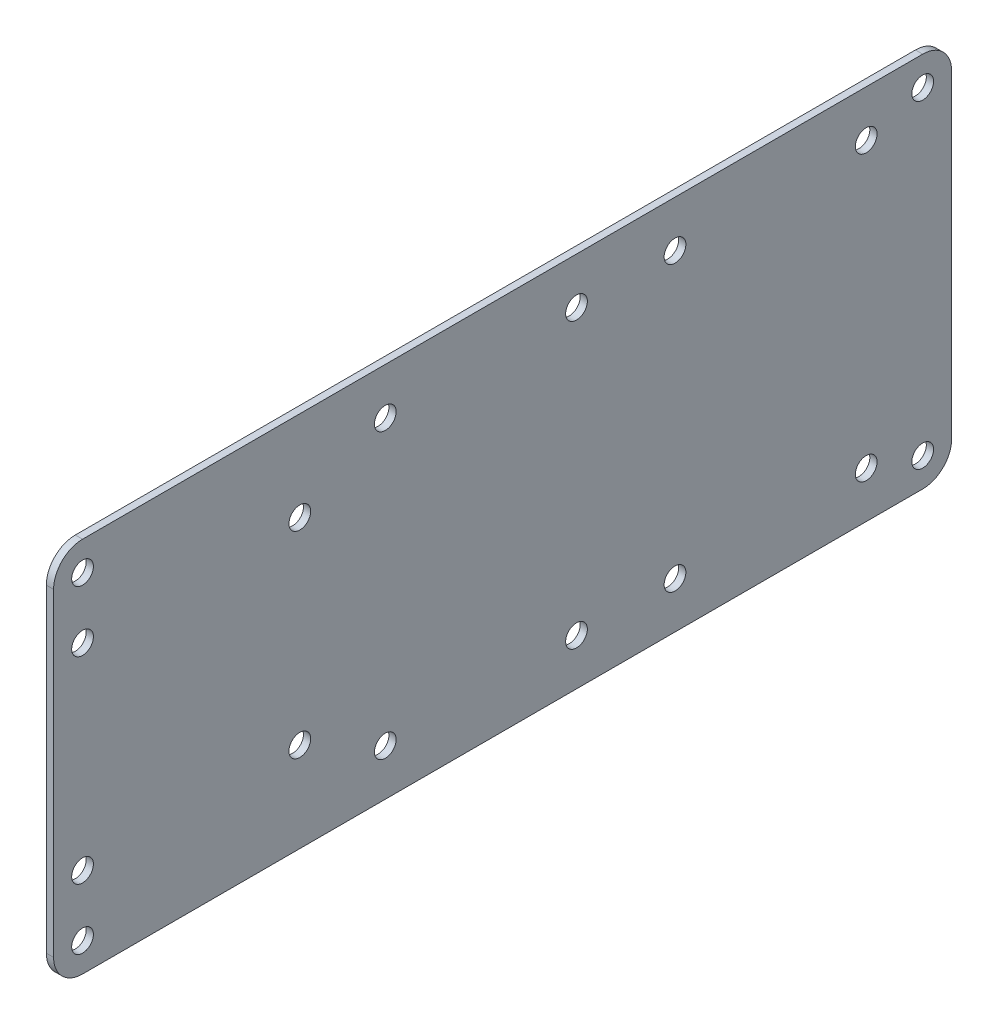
SolidWorks part; units mm, degrees
ref_plane "Front Plane" through (0, 0, 0) normal (0, 0, 1) x (1, 0, 0)
ref_plane "Top Plane" through (0, 0, 0) normal (0, 1, 0) x (1, 0, 0)
ref_plane "Right Plane" through (0, 0, 0) normal (1, 0, 0) x (0, 0, -1)
sketch "Sketch1" plane through (0, 0, 0) normal (1, 0, 0) x (0, 0, -1)
  line L1 (0, 0) -> (196.85, 0)
  line L2 (0, 0) -> (0, -82.55)
  line L3 (0, -82.55) -> (196.85, -82.55)
  line L4 (196.85, 0) -> (196.85, -82.55)
  line L5 (6.35, -6.35) -> (190.5, -6.35) construction
  line L6 (6.35, -6.35) -> (6.35, -76.2) construction
  line L7 (6.35, -76.2) -> (190.5, -76.2) construction
  line L8 (190.5, -6.35) -> (190.5, -76.2) construction
  circle A0 centre (6.35, -6.35) radius 2.3813
  circle A1 centre (6.35, -76.2) radius 2.3813
  circle A2 centre (190.5, -76.2) radius 2.3813
  circle A3 centre (190.5, -6.35) radius 2.3813
  dimension "D7" = 4.7625
  dimension "D1" = 196.85
  dimension "D2" = 82.55
  dimension "D3" = 6.35
  dimension "D4" = 6.35
  dimension "D5" = 6.35
  dimension "D6" = 6.35
extrude "Boss-Extrude1" add sketch "Sketch1" along normal blind 1.5875
sketch "Sketch2" plane through (1.5875, 0, 0) normal (1, 0, 0) x (0, 0, -1)
  line L0 (0, 0) -> (0, -82.55) construction
  line L1 (6.35, -19.685) -> (53.975, -19.685) construction
  line L2 (6.35, -19.685) -> (6.35, -62.865) construction
  line L3 (6.35, -62.865) -> (53.975, -62.865) construction
  line L4 (53.975, -19.685) -> (53.975, -62.865) construction
  line L5 (6.35, -19.685) -> (53.975, -62.865) construction
  line L6 (6.35, -62.865) -> (53.975, -19.685) construction
  line L7 (72.7075, -10.16) -> (114.6175, -10.16) construction
  line L8 (72.7075, -10.16) -> (72.7075, -72.39) construction
  line L9 (72.7075, -72.39) -> (114.6175, -72.39) construction
  line L10 (114.6175, -10.16) -> (114.6175, -72.39) construction
  line L11 (72.7075, -10.16) -> (114.6175, -72.39) construction
  line L12 (72.7075, -72.39) -> (114.6175, -10.16) construction
  line L13 (136.2075, -72.39) -> (136.2075, -10.16) construction
  line L14 (136.2075, -72.39) -> (178.1175, -72.39) construction
  line L15 (178.1175, -72.39) -> (178.1175, -10.16) construction
  line L16 (136.2075, -10.16) -> (178.1175, -10.16) construction
  line L17 (136.2075, -72.39) -> (178.1175, -10.16) construction
  line L18 (178.1175, -72.39) -> (136.2075, -10.16) construction
  circle A0 centre (6.35, -19.685) radius 2.3813
  circle A1 centre (6.35, -62.865) radius 2.3813
  circle A2 centre (53.975, -62.865) radius 2.3812
  circle A3 centre (53.975, -19.685) radius 2.3812
  circle A4 centre (72.7075, -10.16) radius 2.3813
  circle A5 centre (114.6175, -10.16) radius 2.3813
  circle A6 centre (114.6175, -72.39) radius 2.3813
  circle A7 centre (72.7075, -72.39) radius 2.3813
  circle A8 centre (136.2075, -72.39) radius 2.3813
  circle A9 centre (136.2075, -10.16) radius 2.3813
  circle A10 centre (178.1175, -10.16) radius 2.3813
  circle A11 centre (178.1175, -72.39) radius 2.3813
  point P0 (30.1625, -41.275)
  point P6 (0, -41.275)
  point P7 (157.1625, -41.275)
  point P12 (93.6625, -41.275)
  dimension "D3" = 4.7625
  dimension "D10" = 4.7625
  dimension "D1" = 43.18
  dimension "D2" = 47.625
  dimension "D4" = 6.35
  dimension "D5" = 41.91
  dimension "D6" = 62.23
  dimension "D7" = 63.5
  dimension "D8" = 62.23
  dimension "D11" = 41.91
  dimension "D12" = 63.5
  dimension "D13" = 62.23
extrude "Cut-Extrude1" cut sketch "Sketch2" against normal blind 1.5875
fillet "Fillet1" radius 6.35 4 edges at (0.7937, 0, -196.85) (0.7937, -82.55, -196.85) (0.7937, -82.55, 0) (0.7937, 0, 0)
